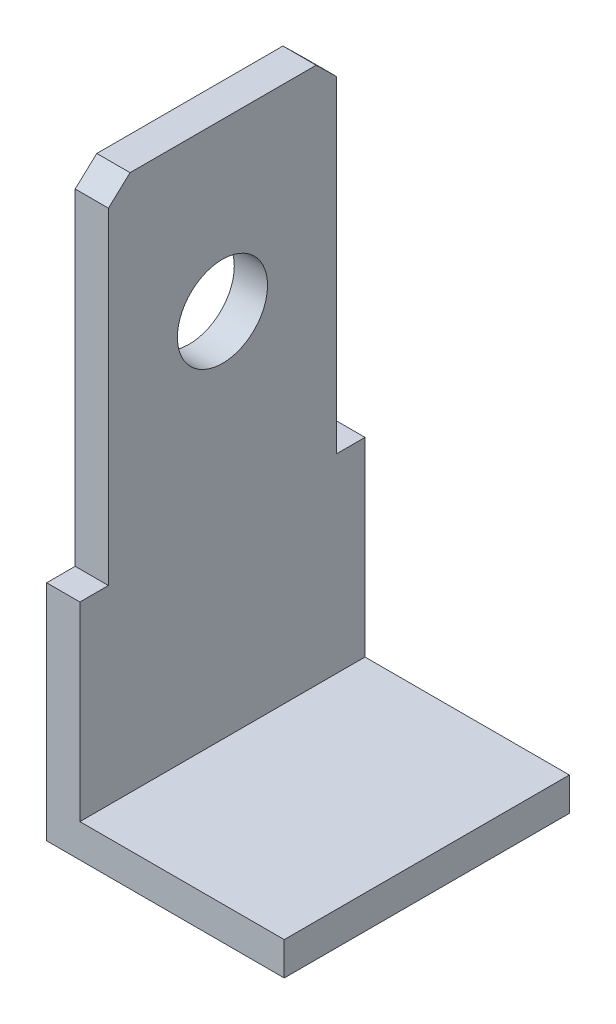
SolidWorks part; units mm, degrees
ref_plane "Ebene vorne" through (0, 0, 0) normal (0, 0, 1) x (1, 0, 0)
ref_plane "Ebene oben" through (0, 0, 0) normal (0, 1, 0) x (1, 0, 0)
ref_plane "Ebene rechts" through (0, 0, 0) normal (1, 0, 0) x (0, 0, -1)
sketch "Skizze1" plane through (0, 0, 0) normal (0, 0, 1) x (1, 0, 0)
  line L0 (0, 0) -> (0, 12)
  line L1 (0, 12) -> (0.7, 12)
  line L2 (0.7, 12) -> (0.7, 0.7)
  line L3 (0.7, 0.7) -> (5, 0.7)
  line L4 (5, 0.7) -> (5, 0)
  line L5 (5, 0) -> (0, 0)
  dimension "D1" = 0.7
  dimension "D2" = 0.7
  dimension "D3" = 5
  dimension "D4" = 12
extrude "Aufsatz-Linear austragen1" add sketch "Skizze1" along normal blind 6
sketch "Skizze2" plane through (0.7, 0, 0) normal (1, 0, 0) x (0, 0, -1)
  line L0 (-3, 12) -> (-3, 8.5) construction
  line L1 (-6, 12) -> (0, 12) construction
  line L2 (-0.6, 11.5805) -> (-0.6, 4.7033)
  line L3 (-0.6, 4.7033) -> (0, 4.7033)
  line L4 (0, 0.7) -> (0, 12) construction
  line L5 (-5.4, 11.5805) -> (-5.4, 4.7033)
  line L6 (-5.4, 4.7033) -> (-6, 4.7033)
  line L7 (-6, 0.7) -> (-6, 12) construction
  line L8 (-1.028, 12) -> (-0.6, 11.5805)
  line L9 (-5.4, 11.5805) -> (-4.9445, 12)
  line L10 (-6, 4.7033) -> (-6, 12)
  line L11 (-6, 12) -> (-4.9445, 12)
  line L12 (-1.028, 12) -> (0, 12)
  line L13 (0, 12) -> (0, 4.7033)
  circle A0 centre (-3, 8.5) radius 0.9489
  dimension "D1" = 3.5
  dimension "D2" = 4.8
  dimension "D3" = 0.6
extrude "Schnitt-Linear austragen1" cut sketch "Skizze2" against normal blind 1
